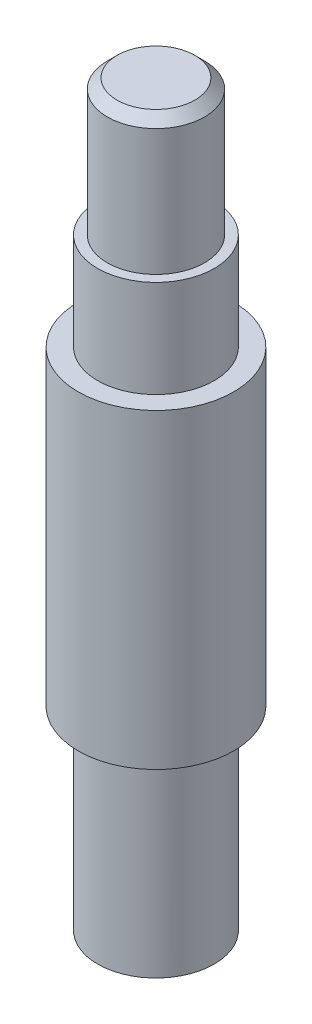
SolidWorks part; units mm, degrees
ref_plane "Front Plane" through (0, 0, 0) normal (0, 0, 1) x (1, 0, 0)
ref_plane "Top Plane" through (0, 0, 0) normal (0, 1, 0) x (1, 0, 0)
ref_plane "Right Plane" through (0, 0, 0) normal (1, 0, 0) x (0, 0, -1)
sketch "Sketch1" plane through (0, 0, 0) normal (0, 1, 0) x (1, 0, 0)
  circle A0 centre (0, 0) radius 4
  dimension "D1" = 8
extrude "Extrude1" add sketch "Sketch1" along normal blind 16
sketch "Sketch2" plane through (0, 0, 0) normal (0, -1, 0) x (1, 0, 0)
  circle A0 centre (0, 0) radius 3
  dimension "D1" = 6
extrude "Extrude2" add sketch "Sketch2" along normal blind 10
sketch "Sketch3" plane through (0, 16, 0) normal (0, 1, 0) x (1, 0, 0)
  circle A0 centre (0, 0) radius 3
  dimension "D1" = 6
extrude "Extrude3" add sketch "Sketch3" along normal blind 5
sketch "Sketch4" plane through (0, 21, 0) normal (0, 1, 0) x (1, 0, 0)
  circle A0 centre (0, 0) radius 2.5
  dimension "D1" = 5
extrude "Extrude4" add sketch "Sketch4" along normal blind 7
chamfer "Chamfer1" distance 0.5 angle 45 1 edges at (0, 28, 2.5)
